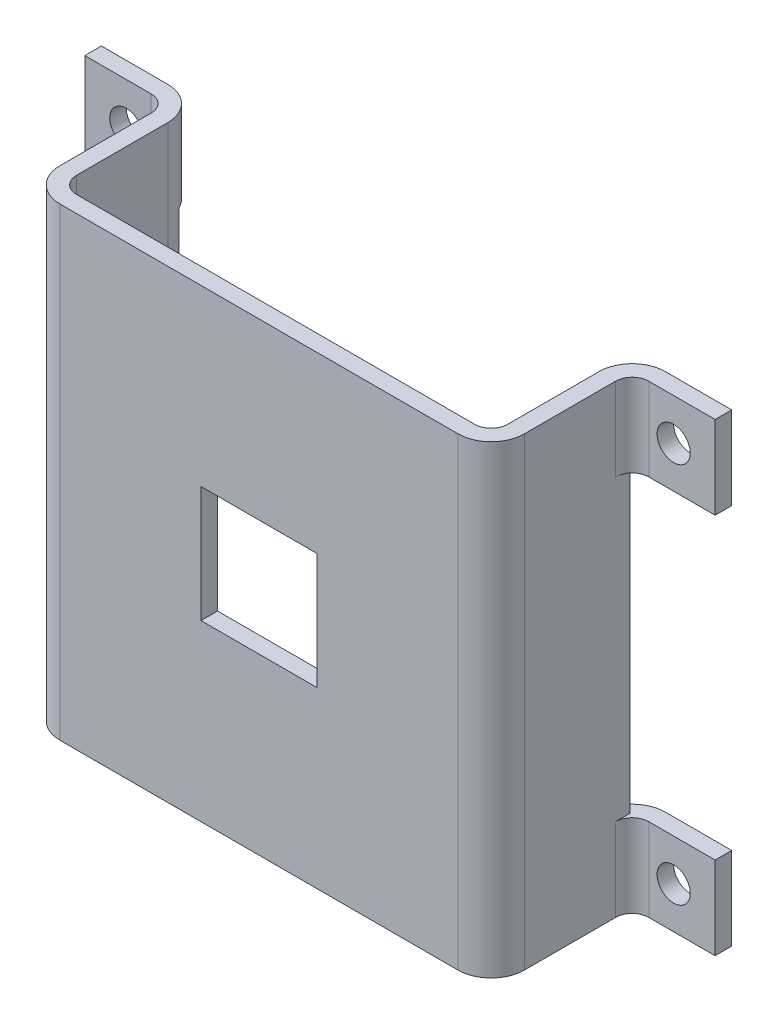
SolidWorks part; units mm, degrees
ref_plane "Plan de face" through (0, 0, 0) normal (0, 0, 1) x (1, 0, 0)
ref_plane "Plan de dessus" through (0, 0, 0) normal (0, 1, 0) x (1, 0, 0)
ref_plane "Plan de droite" through (0, 0, 0) normal (1, 0, 0) x (0, 0, -1)
sketch "Esquisse1" plane through (0, 0, 0) normal (0, 0, 1) x (1, 0, 0)
  line L1 (0, 14) -> (14, 14)
  line L2 (0, 14) -> (0, -14)
  line L3 (0, -14) -> (14, -14)
  line L4 (14, 14) -> (14, -14)
  dimension "D1" = 14
  dimension "D2" = 28
  dimension "D3" = 14
  dimension "D4" = 14
extrude "Extrusion1" add sketch "Esquisse1" along normal blind 1
sketch "Esquisse2" plane through (0, 0, 0) normal (0, 0, -1) x (-1, 0, 0)
  line L0 (0, -14) -> (-14, -14) construction
  line L1 (-14, 14) -> (-13, 14)
  line L2 (-14, 14) -> (-14, -14)
  line L3 (-14, -14) -> (-13, -14)
  line L4 (-13, 14) -> (-13, -14)
  dimension "D1" = 1
extrude "Extrusion2" add sketch "Esquisse2" along normal blind 8.5
sketch "Esquisse3" plane through (14, 0, 0) normal (1, 0, 0) x (0, 0, -1)
  line L1 (8.5, 14) -> (7.5, 14)
  line L2 (8.5, 14) -> (8.5, 9)
  line L3 (8.5, 9) -> (7.5, 9)
  line L4 (7.5, 14) -> (7.5, 9)
  line L5 (8.5, -14) -> (7.5, -14)
  line L6 (8.5, -14) -> (8.5, -9)
  line L7 (8.5, -9) -> (7.5, -9)
  line L8 (7.5, -14) -> (7.5, -9)
  dimension "D1" = 5
  dimension "D2" = 1
  dimension "D3" = 5
  dimension "D4" = 1
extrude "Extrusion3" add sketch "Esquisse3" along normal blind 5
sketch "Esquisse4" plane through (0, 0, 1) normal (0, 0, 1) x (1, 0, 0)
  line L0 (0, 14) -> (0, -14) construction
  line L1 (0, 3.5) -> (3.5, 3.5)
  line L2 (0, 3.5) -> (0, -3.5)
  line L3 (0, -3.5) -> (3.5, -3.5)
  line L4 (3.5, 3.5) -> (3.5, -3.5)
  dimension "D1" = 7
  dimension "D2" = 3.5
  dimension "D3" = 3.5
extrude "Enlèv. mat.-Extru.1" cut sketch "Esquisse4" against normal through all
sketch "Esquisse5" plane through (0, 0, -7.5) normal (0, 0, 1) x (1, 0, 0)
  circle A0 centre (16.5, 11.5) radius 1
  circle A1 centre (16.5, -11.5) radius 1
  dimension "D1" = 2
  dimension "D2" = 2
  dimension "D3" = 16.5
  dimension "D5" = 23
  dimension "D6" = 16.5
  dimension "D4" = 11.5
extrude "Enlèv. mat.-Extru.2" cut sketch "Esquisse5" against normal through all
fillet "Congé1" radius 1 3 edges at (14, -11.5, -7.5)
fillet "Congé2" radius 2 2 edges at (13, 0, -8.5) (14, 0, 1)
sketch "Esquisse6" plane through (14, 0, 0) normal (1, 0, 0) x (0, 0, -1)
  line L0 (6.5, 9) -> (8.2321, 9) construction
  line L1 (8.2321, -9) -> (7.366, -9)
  line L2 (8.2321, -9) -> (8.2321, 9)
  line L3 (8.2321, 9) -> (7.366, 9)
  line L4 (7.366, -9) -> (7.366, 9)
extrude "Enlèv. mat.-Extru.3" cut sketch "Esquisse6" against normal through all
mirror "Symétrie1" about plane through (0, 14, 1) normal (1, 0, 0)
